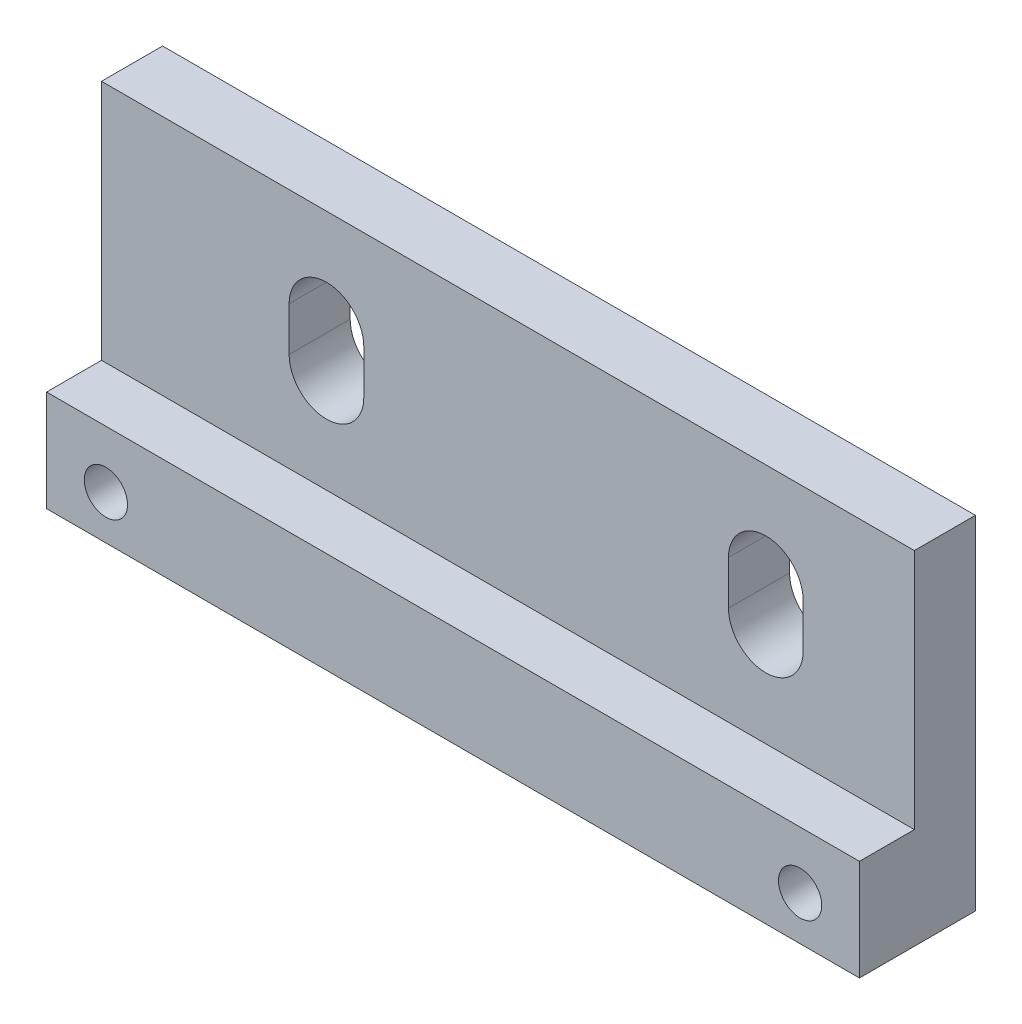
SolidWorks part; units mm, degrees
ref_plane "Front Plane" through (0, 0, 0) normal (0, 0, 1) x (1, 0, 0)
ref_plane "Top Plane" through (0, 0, 0) normal (0, 1, 0) x (1, 0, 0)
ref_plane "Right Plane" through (0, 0, 0) normal (1, 0, 0) x (0, 0, -1)
sketch "Sketch1" plane through (0, 0, 0) normal (0, 0, 1) x (1, 0, 0)
  line L0 (23.495, 9.906) -> (-23.495, -9.906) construction
  line L1 (-23.495, 9.906) -> (23.495, 9.906)
  line L2 (-23.495, 9.906) -> (-23.495, -9.906)
  line L3 (-23.495, -9.906) -> (23.495, -9.906)
  line L4 (23.495, 9.906) -> (23.495, -9.906)
  point P4 (0, 0)
  dimension "D1" = 19.812
  dimension "D2" = 46.99
extrude "Extrude1" add sketch "Sketch1" along normal blind 6.7056
sketch "Sketch2" plane through (23.495, 0, 0) normal (1, 0, 0) x (0, 0, -1)
  line L1 (-6.7056, 9.906) -> (-3.5306, 9.906)
  line L2 (-6.7056, 9.906) -> (-6.7056, -4.064)
  line L3 (-6.7056, -4.064) -> (-3.5306, -4.064)
  line L4 (-3.5306, 9.906) -> (-3.5306, -4.064)
  line L5 (-6.7056, -9.906) -> (0, -9.906) construction
  dimension "D1" = 3.175
  dimension "D2" = 5.842
extrude "Cut-Extrude1" cut sketch "Sketch2" against normal up to next
hole_wizard "M3x0.5 Tapped Hole1" positions "3DSketch1" profile "Sketch3" tap size "M3x0.5" standard "Ansi Metric"
sketch3d "3DSketch1"
  line L0 (23.495, -9.906, 6.7056) -> (23.495, -4.064, 6.7056) construction
  line L1 (-23.495, -9.906, 6.7056) -> (23.495, -9.906, 6.7056) construction
  point P0 (-20.066, -7.366, 6.7056)
  point P2 (20.066, -7.366, 6.7056)
  dimension "D1" = 40.132
  dimension "D2" = 3.429
  dimension "D3" = 2.54
sketch "Sketch3" plane through (-20.066, -7.366, 6.7056) normal (1, 0, 0) x (0, -1, 0)
  line L0 (0, 0) -> (0, 6.7056)
  line L1 (0, 6.7056) -> (1.25, 6.7056)
  line L2 (1.25, 6.7056) -> (1.25, 0)
  line L5 (1.25, 0) -> (0, 0)
  line L11 (0, -6.35) -> (0, 107.95) construction
  dimension "Thru Tap Drill Dia." = 2.5
  dimension "Thru Tap Drill Depth" = 6.7056
sketch "Sketch4" plane through (0, 0, 3.5306) normal (0, 0, 1) x (1, 0, 0)
  line L0 (23.495, -4.064) -> (23.495, 9.906) construction
  line L1 (-23.495, 9.906) -> (23.495, 9.906) construction
  line L2 (-8.3312, 4.191) -> (-8.3312, 1.651)
  line L3 (-12.6492, 4.191) -> (-12.6492, 1.651)
  line L4 (12.7508, 4.191) -> (12.7508, 1.651)
  line L5 (17.0688, 4.191) -> (17.0688, 1.651)
  arc A0 (17.0688, 4.191) -> (12.7508, 4.191) centre (14.9098, 4.191) ccw
  arc A1 (-8.3312, 4.191) -> (-12.6492, 4.191) centre (-10.4902, 4.191) ccw
  arc A2 (-12.6492, 1.651) -> (-8.3312, 1.651) centre (-10.4902, 1.651) ccw
  arc A3 (12.7508, 1.651) -> (17.0688, 1.651) centre (14.9098, 1.651) ccw
  dimension "D2" = 8.5852
  dimension "D4" = 4.318
  dimension "D5" = 2.54
  dimension "D1" = 25.4
  dimension "D3" = 5.715
extrude "Cut-Extrude2" cut sketch "Sketch4" against normal through all
